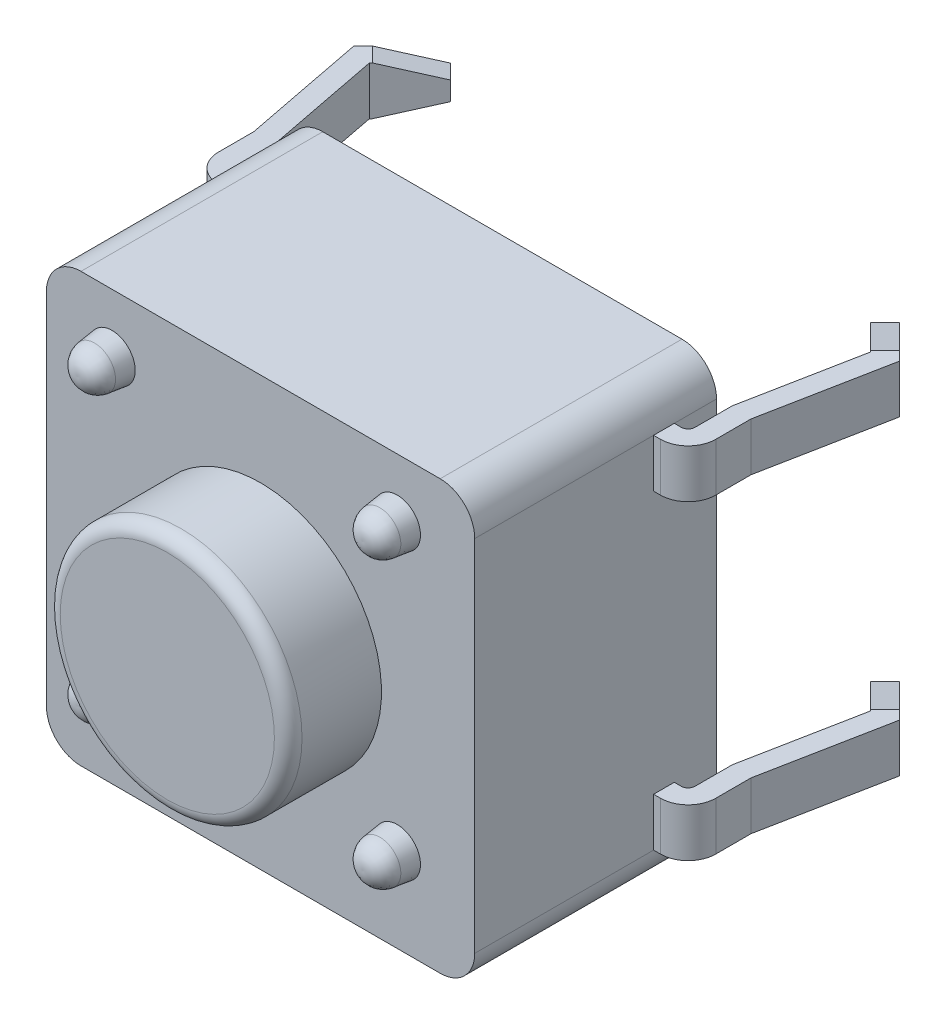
SolidWorks part; units mm, degrees
ref_plane "Front Plane" through (0, 0, 0) normal (0, 0, 1) x (1, 0, 0)
ref_plane "Top Plane" through (0, 0, 0) normal (0, 1, 0) x (1, 0, 0)
ref_plane "Right Plane" through (0, 0, 0) normal (1, 0, 0) x (0, 0, -1)
sketch "Sketch1" plane through (0, 0, 0) normal (0, 0, 1) x (1, 0, 0)
  line L1 (-3.1, -3.1) -> (3.1, -3.1)
  line L2 (-3.1, -3.1) -> (-3.1, 3.1)
  line L3 (-3.1, 3.1) -> (3.1, 3.1)
  line L4 (3.1, -3.1) -> (3.1, 3.1)
  dimension "D1" = 6.2
  dimension "D2" = 3.1
  dimension "D3" = 6.2
  dimension "D4" = 3.1
extrude "Extrude1" add sketch "Sketch1" along normal blind 3.5
sketch "Sketch2" plane through (0, 0, 3.5) normal (0, 0, 1) x (1, 0, 0)
  circle A0 centre (0, 0) radius 1.75
  dimension "D1" = 3.5
extrude "Extrude2" add sketch "Sketch2" along normal blind 1.35
ref_plane "Plane1" through (0, 2.25, 0) normal (0, 1, 0) x (-1, 0, 0)
sketch "Sketch4" plane through (0, 2.25, 0) normal (0, 1, 0) x (-1, 0, 0)
  line L0 (-3.1, 3.5) -> (3.1, 3.5) construction
  line L1 (1.8153, 3.5) -> (2.15, 3.5)
  line L2 (2.15, 2.8444) -> (2.15, 4.4038) construction
  line L3 (1.8464, 3.7535) -> (1.8153, 3.5)
  line L4 (2.15, 4) -> (2.15, 3.5)
  arc A0 (1.8464, 3.7535) -> (2.15, 4) centre (2.1262, 3.7191) cw
  dimension "D1" = 7
  dimension "D2" = 0.5
  dimension "D3" = 2.15
revolve "Revolve1" add sketch "Sketch4" angle 360 about L2
pattern_linear "LPattern1" count 2 spacing 4.13 along (1, 0, 0) count 2 spacing 4.13 along (0, -1, 0) of "Revolve1"
fillet "Fillet1" radius 0.5 4 edges at (3.1, 3.1, 1.75) (-3.1, 3.1, 1.75) (3.1, -3.1, 1.75) (-3.1, -3.1, 1.75)
fillet "Fillet2" radius 0.2 1 edges at (1.75, 0, 4.85)
sketch "Sketch5" plane through (0, 2.25, 0) normal (0, 1, 0) x (-1, 0, 0)
  line L0 (3.1, 0.9109) -> (3.2, 0.9109)
  line L1 (3.1, 3.5) -> (3.1, 0) construction
  line L2 (3.6, 0.5109) -> (3.6, 0)
  line L3 (3.6, 0) -> (3.95, -1.8)
  line L4 (3.95, -1.8) -> (3.25, -2.5)
  line L5 (3.1, 0.6109) -> (3.2, 0.6109)
  line L6 (3.3, 0.5109) -> (3.3, -0.0289)
  line L7 (3.3, -0.0289) -> (3.6251, -1.7007)
  line L8 (3.6251, -1.7007) -> (3.0379, -2.2879)
  line L9 (3.1, 0.9109) -> (3.1, 0.6109)
  line L10 (3.0379, -2.2879) -> (3.25, -2.5)
  line L11 (-2.6, 0) -> (2.6, 0) construction
  line L12 (0, 0) -> (0, -3.1425) construction
  line L13 (3.6, 0.9109) -> (3.6, 0) construction
  line L14 (3.1, 0.9109) -> (3.6, 0.9109) construction
  line L15 (3.3, 0.6109) -> (3.3, -0.0289) construction
  line L16 (3.1, 0.6109) -> (3.3, 0.6109) construction
  arc A0 (3.6, 0.5109) -> (3.2, 0.9109) centre (3.2, 0.5109) ccw
  arc A1 (3.3, 0.5109) -> (3.2, 0.6109) centre (3.2, 0.5109) ccw
  dimension "D5" = 0.4
  dimension "D6" = 0.1
  dimension "D2" = 3.25
  dimension "D3" = 3.95
  dimension "D4" = 2.5
  dimension "D7" = 1.8
  dimension "D8" = 3.6
  dimension "D1" = 0.3
extrude "Extrude3" add sketch "Sketch5" along normal mid plane 0.7
chamfer "Chamfer1" distance 0.8 angle 15 3 edges at (-3.1439, 1.9, -2.3939) (-3.1439, 2.6, -2.3939) (-3.0379, 2.25, -2.2879)
mirror "Mirror1" about plane through (0, 0, 0) normal (0, 1, 0) of "Chamfer1", "Extrude3"
mirror "Mirror2" about plane through (0, 0, 0) normal (1, 0, 0) of "Mirror1", "Chamfer1", "Extrude3"
equation "\"D2@Sketch1\" = \"D1@Sketch1\" / 2"
equation "\"D4@Sketch1\" = \"D3@Sketch1\" / 2"
